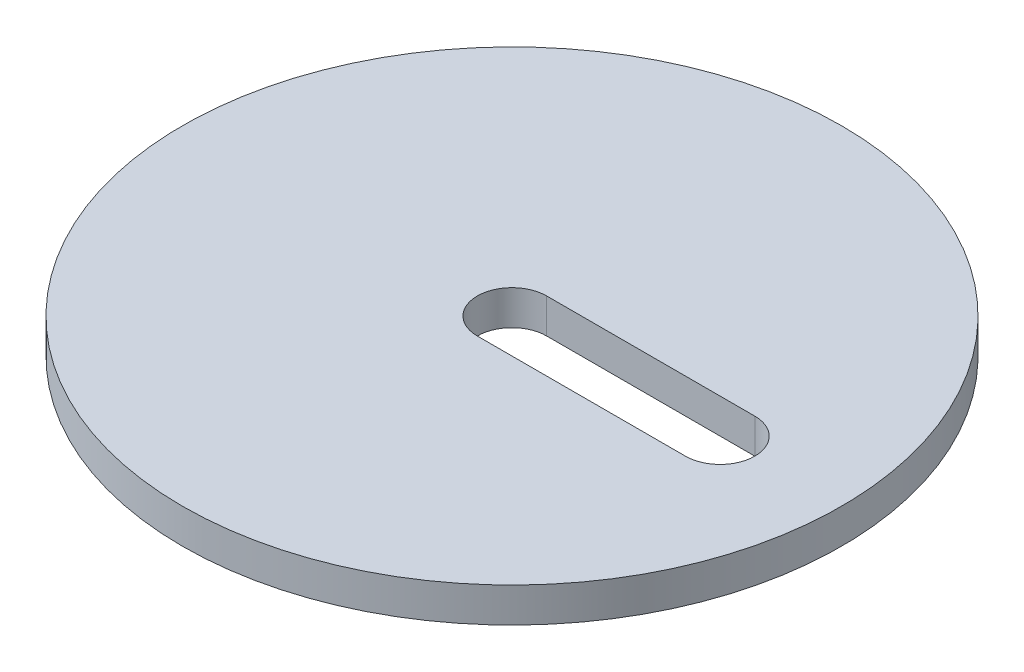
SolidWorks part; units mm, degrees
ref_plane "Front Plane" through (0, 0, 0) normal (0, 0, 1) x (1, 0, 0)
ref_plane "Top Plane" through (0, 0, 0) normal (0, 1, 0) x (1, 0, 0)
ref_plane "Right Plane" through (0, 0, 0) normal (1, 0, 0) x (0, 0, -1)
sketch "Sketch1" plane through (0, 0, 0) normal (0, 1, 0) x (1, 0, 0)
  line L0 (0, 0) -> (19.05, 0) construction
  line L1 (0, 3.175) -> (19.05, 3.175)
  line L2 (0, -3.175) -> (19.05, -3.175)
  circle A0 centre (0, 0) radius 30.1625
  arc A1 (0, 3.175) -> (0, -3.175) centre (0, 0) ccw
  arc A2 (19.05, -3.175) -> (19.05, 3.175) centre (19.05, 0) ccw
  point P3 (9.525, 0)
  dimension "D1" = 19.05
  dimension "D2" = 60.325
  dimension "D3" = 6.35
extrude "Boss-Extrude1" add sketch "Sketch1" along normal blind 3.175
